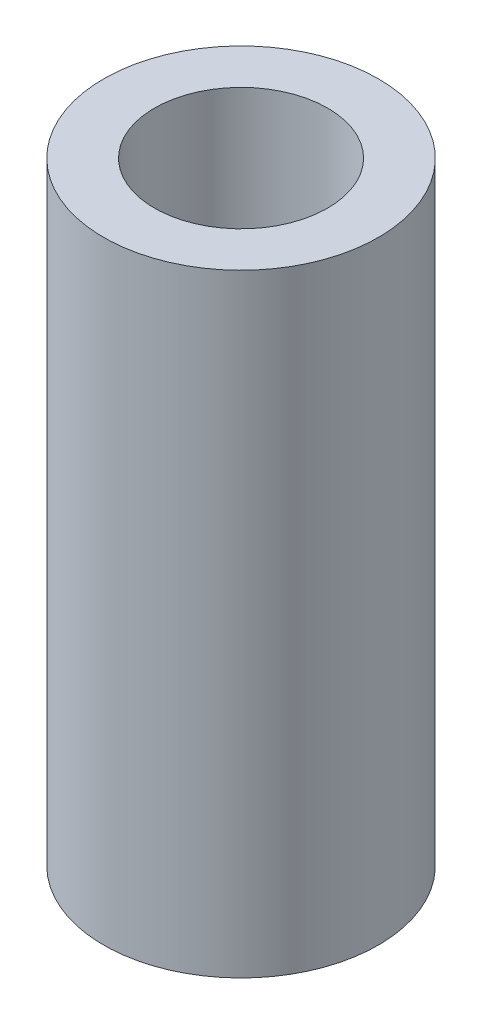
SolidWorks part; units mm, degrees
ref_plane "Plan de face" through (0, 0, 0) normal (0, 0, 1) x (1, 0, 0)
ref_plane "Plan de dessus" through (0, 0, 0) normal (0, 1, 0) x (1, 0, 0)
ref_plane "Plan de droite" through (0, 0, 0) normal (1, 0, 0) x (0, 0, -1)
sketch "Esquisse1" plane through (0, 0, 0) normal (0, 1, 0) x (1, 0, 0)
  circle A0 centre (0, 0) radius 6.5
  circle A1 centre (0, 0) radius 4.1
extrude "Extrusion1" add sketch "Esquisse1" along normal blind 29
